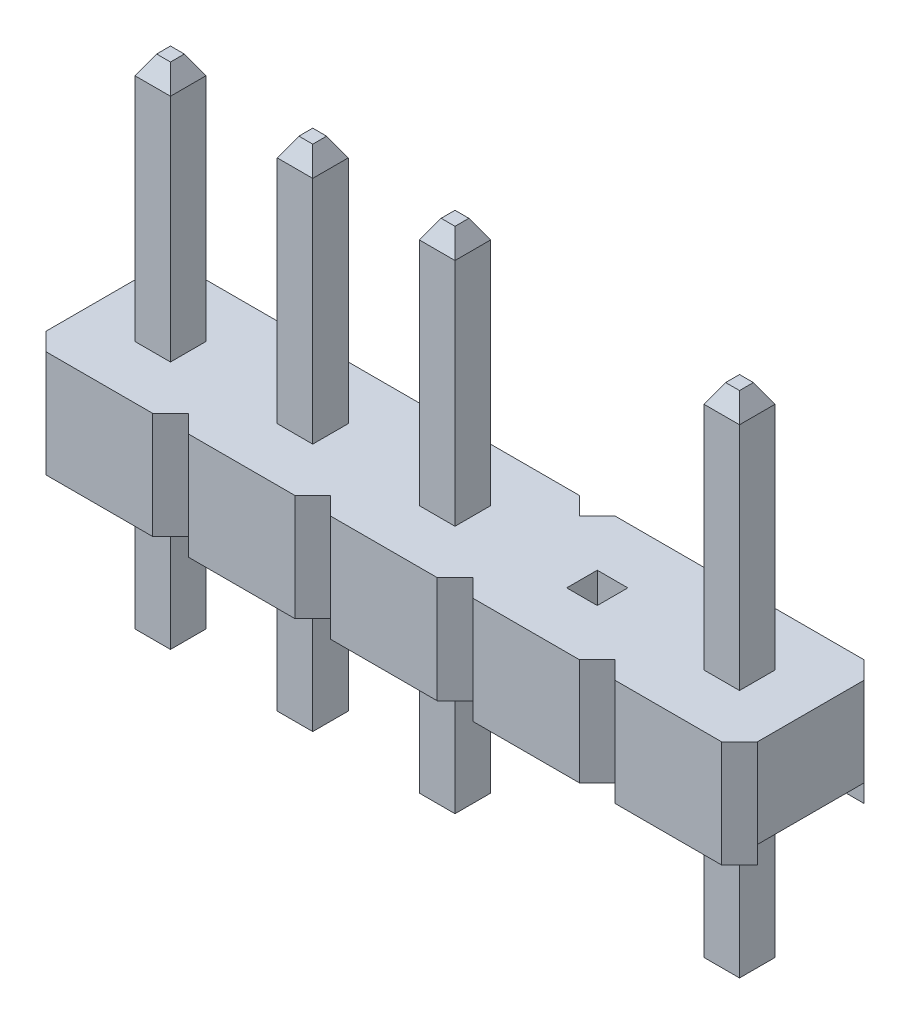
SolidWorks part; units mm, degrees
ref_plane "Front Plane" through (0, 0, 0) normal (0, 0, 1) x (1, 0, 0)
ref_plane "Top Plane" through (0, 0, 0) normal (0, 1, 0) x (1, 0, 0)
ref_plane "Right Plane" through (0, 0, 0) normal (1, 0, 0) x (0, 0, -1)
imported_body "m22-2010546_01-1-solid1"
imported_body "m22-2010546_02-1-solid1"
imported_body "m22-2010546_03-1-solid1"
imported_body "m22-2010546_04-1-solid1"
imported_body "m22-2010546_06-1-solid1"
sketch "Sketch1" plane through (0, 0, 1) normal (0, 0, 1) x (1, 0, 0)
  line L0 (1.75, 3.2359) -> (1.75, -4.6359) construction
  line L1 (1.75, -3.5) -> (10.25, -3.5)
  line L2 (1.75, -3.5) -> (1.75, -4.9)
  line L3 (1.75, -4.9) -> (10.25, -4.9)
  line L4 (10.25, -3.5) -> (10.25, -4.9)
  line L5 (10.25, 3.2359) -> (10.25, -4.6359) construction
  line L6 (10.0975, -4.9) -> (9.9025, -4.9) construction
  line L7 (8.75, -1.5) -> (7.25, -1.5) construction
  dimension "D1" = 2
extrude "Cut-Extrude1" cut sketch "Sketch1" against normal through all both
